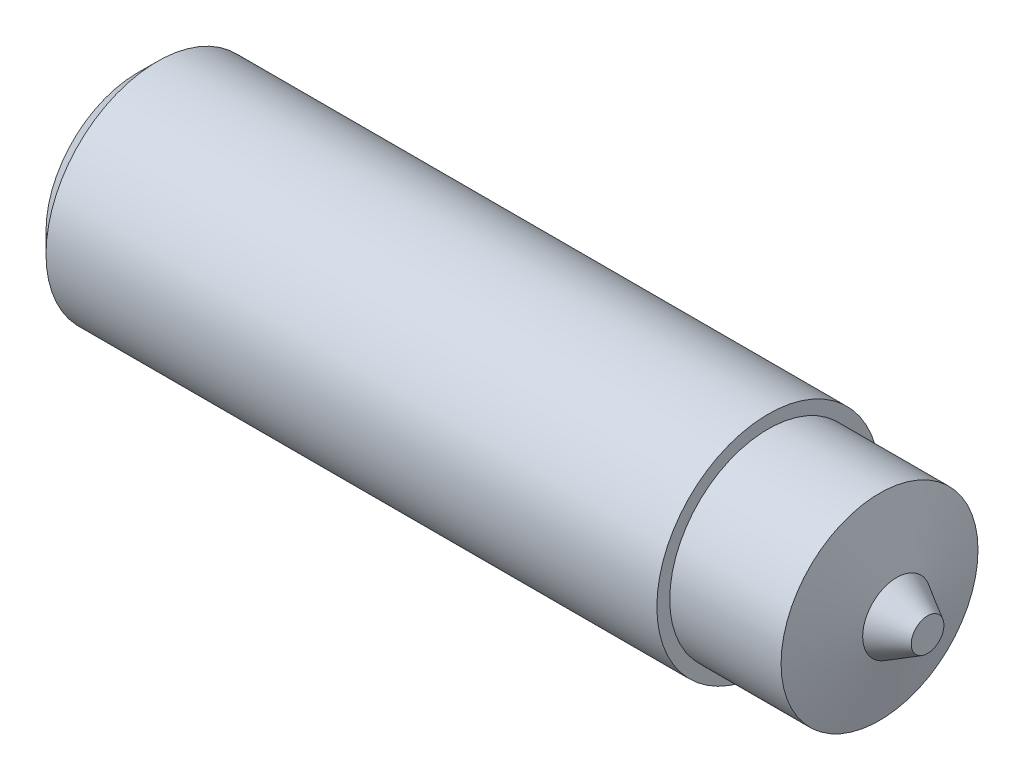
SolidWorks part; units mm, degrees
ref_plane "Front" through (0, 0, 0) normal (0, 0, 1) x (1, 0, 0)
ref_plane "Top" through (0, 0, 0) normal (0, 1, 0) x (1, 0, 0)
ref_plane "Right" through (0, 0, 0) normal (1, 0, 0) x (0, 0, -1)
sketch "Sketch1" plane through (0, 0, 0) normal (0, 0, 1) x (1, 0, 0)
  line L0 (-13.9509, 0) -> (13.0454, 0) construction
  line L1 (0, 0) -> (0, 3)
  line L2 (0, 3) -> (17, 3)
  line L3 (20, 2.6528) -> (20.4645, 0.9192)
  line L4 (17, 3) -> (19.907, 3) construction
  line L5 (17, 3) -> (17, 2.6528)
  line L6 (21.2945, 0.44) -> (21.2945, 0)
  line L7 (21.2945, 0) -> (0, 0)
  line L8 (21.2945, 0.44) -> (20.4645, 0.9192)
  line L9 (17, 2.6528) -> (20, 2.6528)
  dimension "D3" = 30
  dimension "D1" = 5.3055
  dimension "d" = 6
  dimension "a" = 3
  dimension "D4" = 15
  dimension "d2" = 0.88
  dimension "l2" = 0.83
  dimension "l" = 20
revolve "Base" add sketch "Sketch1" angle 360 about L0
chamfer "HeadChamfer" distance 0.5415 angle 45 1 edges at (0, 0, 3)
sketch "Sketch2" plane through (0, 0, 0) normal (0, 0, 1) x (1, 0, 0)
  line L0 (0.5415, 2.531) -> (0.8123, 3)
  line L1 (0.8123, 3) -> (0.8123, 3.5)
  line L2 (0.8123, 3.5) -> (0.2708, 3.5)
  line L3 (0.2708, 3.5) -> (0.2708, 3)
  line L4 (0.2708, 3) -> (0.5415, 2.531)
  line L5 (0, 0) -> (8.4815, 0) construction
  line L6 (0.5415, 3) -> (0.5415, -3) construction
  dimension "D1" = 60
  dimension "D2" = 0.5
  dimension "D3" = 0.5415
  dimension "D4" = 60
  dimension "D5" = 6
revolve "Cut-Revolve10" [suppressed] cut sketch "Sketch2" angle 360 about L5
pattern_linear "LPattern10" [suppressed] count 26 spacing 0.6498 along (1, 0, 0)
equation "\"D1@HeadChamfer\" =  ( \"d@Sketch1\" - \"D2@ThreadCosmetic1\" )  / 2"
equation "\"D5@Sketch2\" = \"d@Sketch1\""
equation "\"D3@Sketch2\" =  ( \"d@Sketch1\" - \"D2@ThreadCosmetic1\" )  / 2"
equation "\"D3@LPattern10\" = \"D3@Sketch2\" * 1.2"
equation "\"D1@LPattern10\" = (  \"l@Sketch1\" - \"a@Sketch1\" )  / \"D3@LPattern10\""
